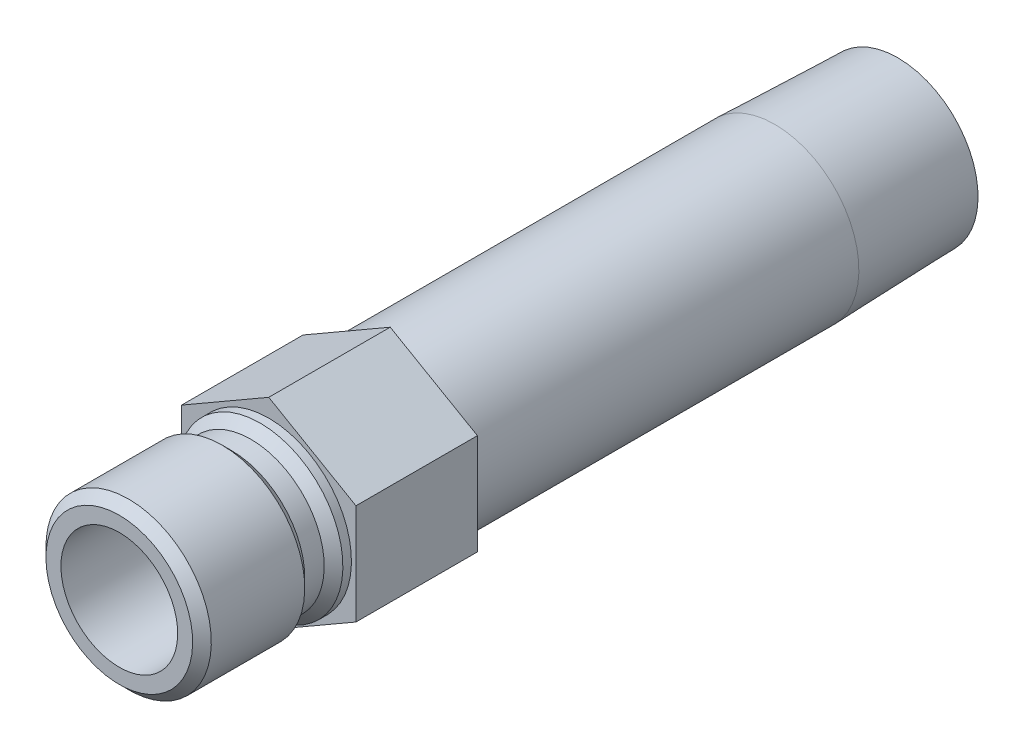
SolidWorks part; units mm, degrees
ref_plane "Front Plane" through (0, 0, 0) normal (0, 0, 1) x (1, 0, 0)
ref_plane "Top Plane" through (0, 0, 0) normal (0, 1, 0) x (1, 0, 0)
ref_plane "Right Plane" through (0, 0, 0) normal (1, 0, 0) x (0, 0, -1)
sketch "Sketch1" plane through (0, 0, 0) normal (1, 0, 0) x (0, 0, -1)
  line L0 (0, 0) -> (-15.367, 0) construction
  line L1 (-12.192, 4.7625) -> (-12.192, 5.9817)
  line L2 (-3.048, 5.9817) -> (-3.048, 0) construction
  line L3 (-11.43, 6.7437) -> (-3.81, 6.7437)
  line L4 (0, 6.858) -> (0, 4.7625) construction
  line L5 (-3.048, 5.9817) -> (-1.4605, 5.9817)
  line L6 (-0.6985, 6.7437) -> (0, 6.7437)
  line L7 (0, 6.7437) -> (0, 6.858)
  line L8 (-3.048, 5.9817) -> (-3.81, 6.7437)
  line L9 (-1.4605, 5.9817) -> (-0.6985, 6.7437)
  line L10 (-12.192, 5.9817) -> (-11.43, 6.7437)
  line L11 (-12.192, 4.7625) -> (0, 4.7625)
  line L12 (0, 6.858) -> (41.275, 6.858)
  line L13 (41.275, 6.858) -> (51.308, 6.5445)
  line L14 (51.308, 6.5445) -> (51.308, 4.6228)
  line L15 (0, 6.7437) -> (9.906, 6.7437) construction
  line L16 (9.906, 6.7437) -> (9.906, 0) construction
  line L17 (9.906, 0) -> (0, 0) construction
  line L19 (0.0743, 4.6228) -> (51.308, 4.6228)
  line L20 (0, 4.7625) -> (0.0743, 4.6228)
  line L21 (0, 4.6272) -> (0, 0) construction
  dimension "D2" = 1.5875
  dimension "D3" = 0.762
  dimension "D4" = 45
  dimension "D5" = 9.144
  dimension "D6" = 45
  dimension "D7" = 1.79
  dimension "D8" = 10.033
  dimension "D9" = 63.5
  dimension "D10" = 3.175
  dimension "D11" = 9.525
  dimension "D12" = 13.716
  dimension "D13" = 22.098
  dimension "D14" = 13.4874
  dimension "D15" = 9.2456
  dimension "D16" = 9.906
  dimension "D17" = 118
  dimension "D18" = 12.192
revolve "Revolve1" add sketch "Sketch1" angle 360 about L0
sketch "Sketch2" plane through (0, 0, 0) normal (0, 0, 1) x (1, 0, 0)
  line L1 (-7.112, 4.1061) -> (-7.112, -4.1061)
  line L2 (-7.112, -4.1061) -> (0, -8.2122)
  line L3 (0, -8.2122) -> (7.112, -4.1061)
  line L4 (7.112, -4.1061) -> (7.112, 4.1061)
  line L5 (7.112, 4.1061) -> (0, 8.2122)
  line L6 (0, 8.2122) -> (-7.112, 4.1061)
  circle A0 centre (0, 0) radius 7.112 construction
  circle A1 centre (0, 0) radius 4.6228 construction
  circle A2 centre (0, 0) radius 4.6228
  dimension "D1" = 14.224
extrude "Boss-Extrude1" add sketch "Sketch2" against normal up to vertex (9.906 mm away) from vertex at 0
